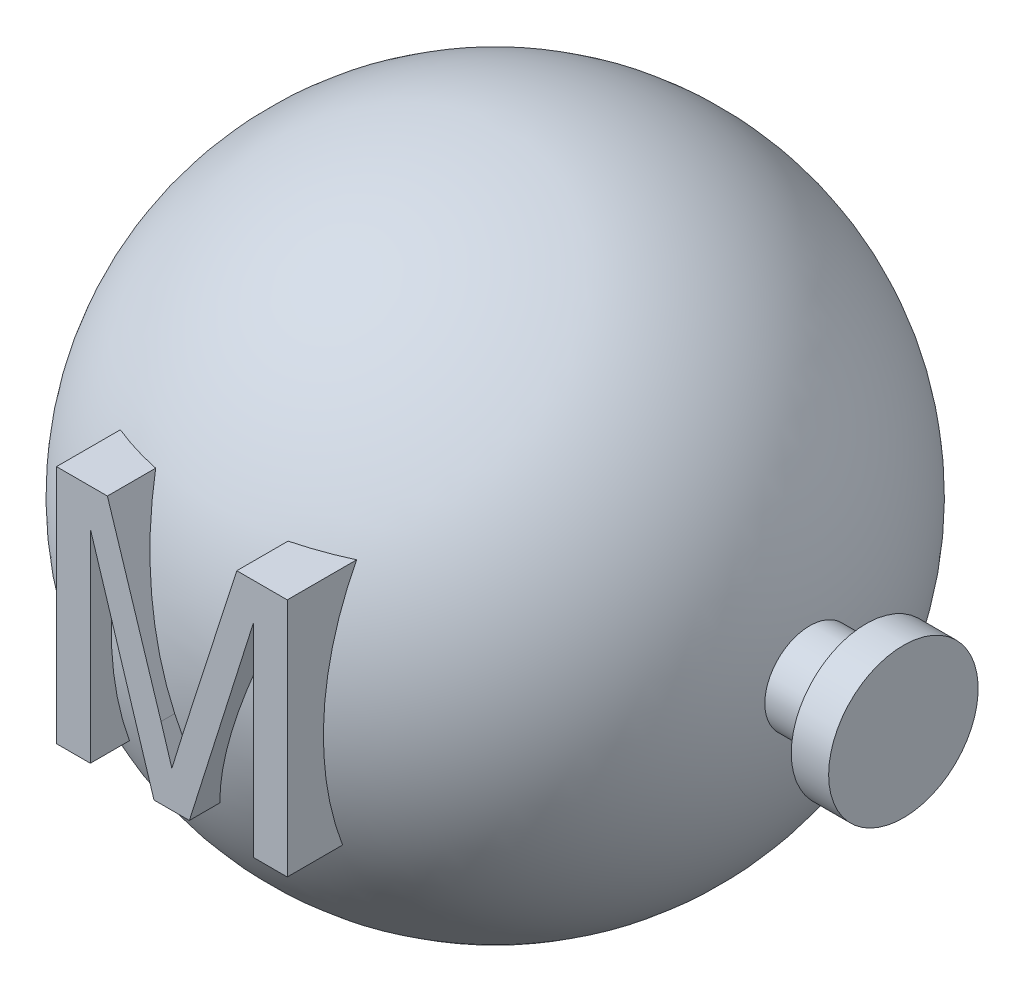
SolidWorks part; units mm, degrees
ref_plane "Plan de face" through (0, 0, 0) normal (0, 0, 1) x (1, 0, 0)
ref_plane "Plan de dessus" through (0, 0, 0) normal (0, 1, 0) x (1, 0, 0)
ref_plane "Plan de droite" through (0, 0, 0) normal (1, 0, 0) x (0, 0, -1)
sketch "Esquisse1" plane through (0, 0, 0) normal (0, 0, 1) x (1, 0, 0)
  line L0 (0, -85) -> (0, 85) construction
  line L1 (0, -85) -> (0, 85)
  arc A0 (0, 85) -> (0, -85) centre (0, 0) ccw
  dimension "D1" = 85
revolve "Révolution1" add sketch "Esquisse1" angle 360 about L0
sketch "Esquisse2" plane through (0, 0, 0) normal (0, 0, 1) x (1, 0, 0)
  line L0 (0, 0) -> (77.6654, 0) construction
  line L1 (0, 12) -> (99.2136, 12)
  line L2 (0, 12) -> (0, 0)
  line L3 (109.2136, 20) -> (109.2136, 0)
  line L4 (0, 0) -> (109.2136, 0)
  line L7 (109.2136, 20) -> (99.2136, 20)
  line L8 (99.2136, 12) -> (99.2136, 20)
  dimension "D1" = 12
  dimension "D3" = 10
revolve "Révolution2" add sketch "Esquisse2" angle 360 about L0
sketch "Esquisse3" plane through (0, 0, 0) normal (0, 0, 1) x (1, 0, 0)
  text T0 "M" font "Arial" height in points 250
extrude "Extrusion1" add sketch "Esquisse3" along normal blind 88.1866
